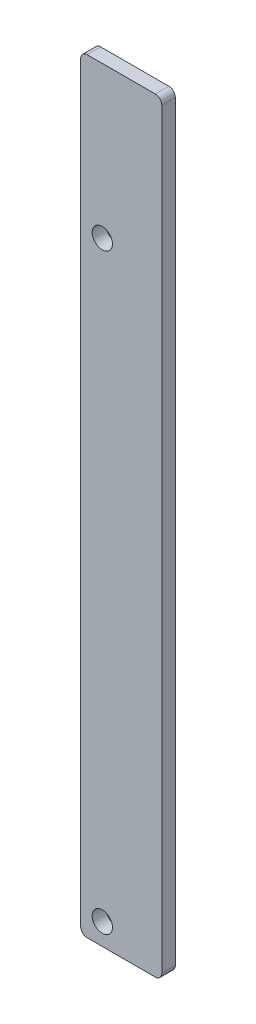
SolidWorks part; units mm, degrees
ref_plane "Front" through (0, 0, 0) normal (0, 0, 1) x (1, 0, 0)
ref_plane "Top" through (0, 0, 0) normal (0, 1, 0) x (1, 0, 0)
ref_plane "Right" through (0, 0, 0) normal (1, 0, 0) x (0, 0, -1)
sketch "Sketch1" plane through (0, 0, 0) normal (0, 0, 1) x (1, 0, 0)
  line L0 (-1199.9522, -177.165) -> (-1199.9522, -46.2043) construction
  line L1 (-1200.2062, -20.32) -> (-1216.2082, -20.32)
  line L2 (-1198.6822, -21.844) -> (-1198.6822, -198.501)
  line L3 (-1200.2062, -200.025) -> (-1216.2082, -200.025)
  line L4 (-1217.7322, -21.844) -> (-1217.7322, -198.501)
  line L5 (-1196.34, -180.975) -> (-745.49, -180.975) construction
  arc A0 (-1216.2082, -20.32) -> (-1217.7322, -21.844) centre (-1216.2082, -21.844) ccw
  arc A1 (-1198.6822, -198.501) -> (-1200.2062, -200.025) centre (-1200.2062, -198.501) cw
  arc A2 (-1216.2082, -200.025) -> (-1217.7322, -198.501) centre (-1216.2082, -198.501) cw
  arc A3 (-1200.2062, -20.32) -> (-1198.6822, -21.844) centre (-1200.2062, -21.844) cw
  point P14 (-1198.6822, -200.025)
  point P17 (-1217.7322, -200.025)
  dimension "D5" = 1.524
  dimension "D1" = 1.27
  dimension "D2" = 2.54
  dimension "D3" = 19.05
  dimension "D4" = 19.05
extrude "Boss-Extrude1" add sketch "Sketch1" along normal blind 3.175 separate body
hole_wizard "Hole1" positions "Point_Sketch" profile "Profil_Sketch" hole size "Ø0.15" standard "ISO"
sketch "Point_Sketch" plane through (-1216.3065, -45.2789, 3.175) normal (0, 0, -1) x (1, 0, 0)
  point P0 (3.6543, 10.6011)
  point P2 (3.6543, 149.6661)
sketch "Profil_Sketch" plane through (-1212.6522, -55.88, 3.175) normal (1, 0, 0) x (0, -1, 0)
  line L0 (0, 0) -> (0, 3.175)
  line L1 (0, 3.175) -> (2.3812, 3.175)
  line L2 (2.3812, 3.175) -> (2.3813, 0)
  line L5 (2.3813, 0) -> (0, 0)
  line L11 (0, -6.35) -> (0, 107.95) construction
  dimension "Diameter" = 4.7625
  dimension "Thru Hole Depth" = 3.175
other "usin_DL090_8-32x.375-BHCS<1>"
